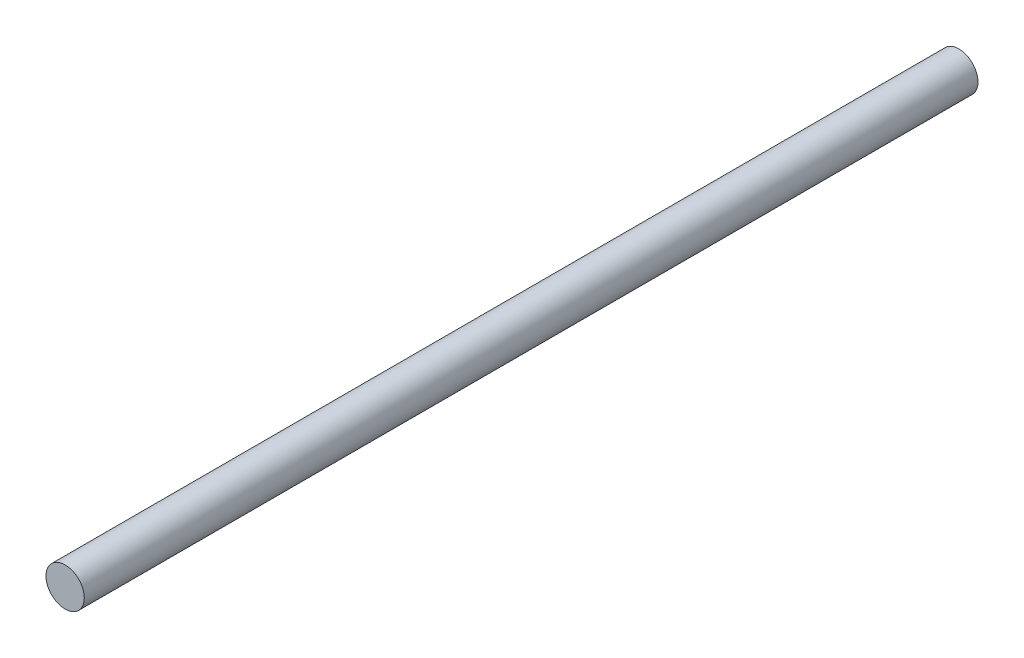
SolidWorks part; units mm, degrees
ref_plane "Front Plane" through (0, 0, 0) normal (0, 0, 1) x (1, 0, 0)
ref_plane "Top Plane" through (0, 0, 0) normal (0, 1, 0) x (1, 0, 0)
ref_plane "Right Plane" through (0, 0, 0) normal (1, 0, 0) x (0, 0, -1)
sketch "Sketch1" plane through (0, 0, 0) normal (0, 0, 1) x (1, 0, 0)
  circle A0 centre (0, 0) radius 30
  dimension "D1" = 60
extrude "Boss-Extrude1" add sketch "Sketch1" against normal blind 1400
